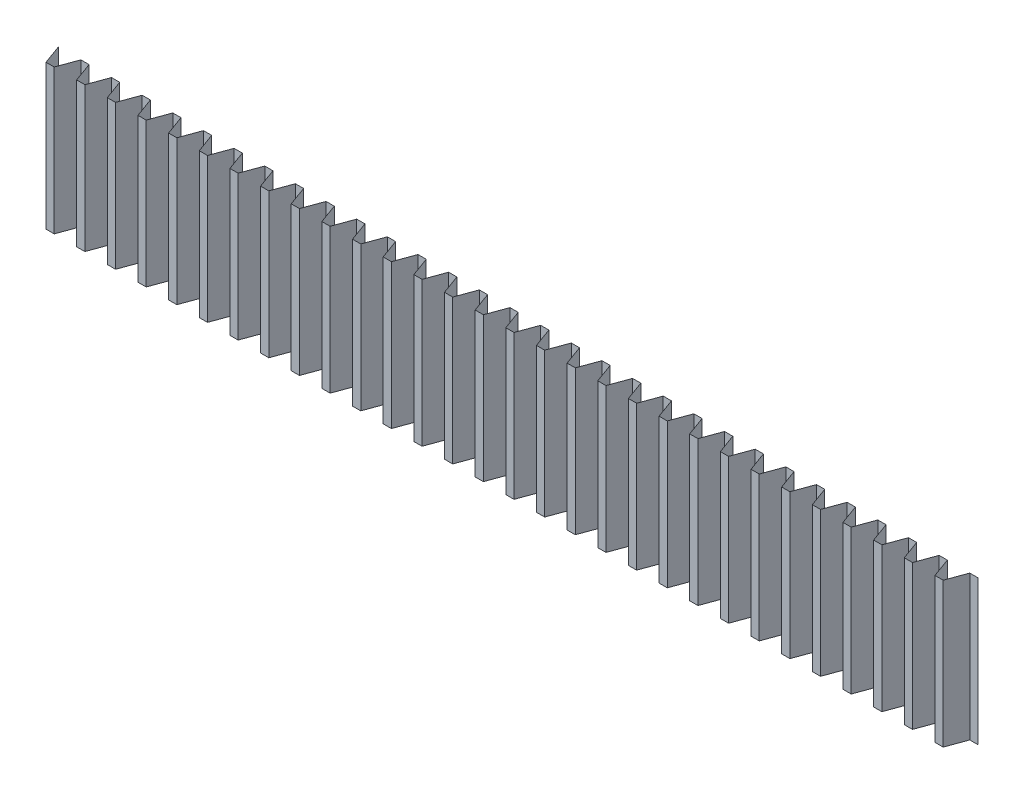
SolidWorks part; units mm, degrees
ref_plane "Vorne" through (0, 0, 0) normal (0, 0, 1) x (1, 0, 0)
ref_plane "Oben" through (0, 0, 0) normal (0, 1, 0) x (1, 0, 0)
ref_plane "Rechts" through (0, 0, 0) normal (1, 0, 0) x (0, 0, -1)
sketch "Skizze1" plane through (0, 0, 0) normal (0, 1, 0) x (1, 0, 0)
  line L0 (-56.2728, 2.7) -> (-53.9971, 2.7)
  line L1 (-53.9971, 2.7) -> (-52.0317, -2.7)
  line L2 (-62.4794, 2.7) -> (-60.514, -2.7)
  line L3 (-60.514, -2.7) -> (-58.2382, -2.7)
  line L4 (-58.2382, -2.7) -> (-56.2728, 2.7)
  line L5 (0, 2.7) -> (0, -2.7) construction
  line L6 (-52.0317, -2.7) -> (-49.7559, -2.7)
  line L7 (-49.7559, -2.7) -> (-47.7905, 2.7)
  line L8 (-47.7905, 2.7) -> (-45.5148, 2.7)
  line L9 (-45.5148, 2.7) -> (-43.5494, -2.7)
  line L10 (-43.5494, -2.7) -> (-41.2736, -2.7)
  line L11 (-41.2736, -2.7) -> (-39.3082, 2.7)
  line L12 (-39.3082, 2.7) -> (-37.0325, 2.7)
  line L13 (-37.0325, 2.7) -> (-35.0671, -2.7)
  line L14 (-35.0671, -2.7) -> (-32.7913, -2.7)
  line L15 (-32.7913, -2.7) -> (-30.8259, 2.7)
  line L16 (-30.8259, 2.7) -> (-28.5502, 2.7)
  line L17 (-28.5502, 2.7) -> (-26.5848, -2.7)
  line L18 (-26.5848, -2.7) -> (-24.309, -2.7)
  line L19 (-24.309, -2.7) -> (-22.3436, 2.7)
  line L20 (-22.3436, 2.7) -> (-20.0679, 2.7)
  line L21 (-20.0679, 2.7) -> (-18.1025, -2.7)
  line L22 (-18.1025, -2.7) -> (-15.8267, -2.7)
  line L23 (-15.8267, -2.7) -> (-13.8613, 2.7)
  line L24 (-13.8613, 2.7) -> (-11.5856, 2.7)
  line L25 (-11.5856, 2.7) -> (-9.6202, -2.7)
  line L26 (-9.6202, -2.7) -> (-7.3444, -2.7)
  line L27 (-7.3444, -2.7) -> (-5.379, 2.7)
  line L28 (-5.379, 2.7) -> (-3.1033, 2.7)
  line L29 (-3.1033, 2.7) -> (-1.1379, -2.7)
  line L30 (-1.1379, -2.7) -> (1.1379, -2.7)
  line L31 (1.1379, -2.7) -> (3.1033, 2.7)
  line L32 (3.1033, 2.7) -> (5.379, 2.7)
  line L33 (5.379, 2.7) -> (7.3444, -2.7)
  line L34 (7.3444, -2.7) -> (9.6202, -2.7)
  line L35 (9.6202, -2.7) -> (11.5856, 2.7)
  line L36 (11.5856, 2.7) -> (13.8613, 2.7)
  line L37 (13.8613, 2.7) -> (15.8267, -2.7)
  line L38 (15.8267, -2.7) -> (18.1025, -2.7)
  line L39 (18.1025, -2.7) -> (20.0679, 2.7)
  line L40 (20.0679, 2.7) -> (22.3436, 2.7)
  line L41 (22.3436, 2.7) -> (24.309, -2.7)
  line L42 (24.309, -2.7) -> (26.5848, -2.7)
  line L43 (26.5848, -2.7) -> (28.5502, 2.7)
  line L44 (28.5502, 2.7) -> (30.8259, 2.7)
  line L45 (30.8259, 2.7) -> (32.7913, -2.7)
  line L46 (32.7913, -2.7) -> (35.0671, -2.7)
  line L47 (35.0671, -2.7) -> (37.0325, 2.7)
  line L48 (37.0325, 2.7) -> (39.3082, 2.7)
  line L49 (39.3082, 2.7) -> (41.2736, -2.7)
  line L50 (41.2736, -2.7) -> (43.5494, -2.7)
  line L51 (43.5494, -2.7) -> (45.5148, 2.7)
  line L52 (45.5148, 2.7) -> (47.7905, 2.7)
  line L53 (47.7905, 2.7) -> (49.7559, -2.7)
  line L54 (49.7559, -2.7) -> (52.0317, -2.7)
  line L55 (52.0317, -2.7) -> (53.9971, 2.7)
  line L56 (53.9971, 2.7) -> (56.2728, 2.7)
  line L57 (56.2728, 2.7) -> (58.2382, -2.7)
  line L58 (58.2382, -2.7) -> (60.514, -2.7)
  line L59 (60.514, -2.7) -> (62.4794, 2.7)
  line L60 (62.4794, 2.7) -> (64.7551, 2.7)
  line L61 (64.7551, 2.7) -> (66.7205, -2.7)
  line L62 (66.7205, -2.7) -> (68.9963, -2.7)
  line L63 (68.9963, -2.7) -> (70.9617, 2.7)
  line L64 (70.9617, 2.7) -> (73.2374, 2.7)
  line L65 (73.2374, 2.7) -> (75.2028, -2.7)
  line L66 (75.2028, -2.7) -> (77.4786, -2.7)
  line L67 (77.4786, -2.7) -> (79.444, 2.7)
  line L68 (79.444, 2.7) -> (81.7197, 2.7)
  line L69 (81.7197, 2.7) -> (83.6851, -2.7)
  line L70 (83.6851, -2.7) -> (85.9609, -2.7)
  line L71 (85.9609, -2.7) -> (87.9263, 2.7)
  line L72 (87.9263, 2.7) -> (90.202, 2.7)
  line L73 (90.202, 2.7) -> (92.1674, -2.7)
  line L74 (92.1674, -2.7) -> (94.4432, -2.7)
  line L75 (94.4432, -2.7) -> (96.4086, 2.7)
  line L76 (96.4086, 2.7) -> (98.6843, 2.7)
  line L77 (98.6843, 2.7) -> (100.6497, -2.7)
  line L78 (100.6497, -2.7) -> (102.9255, -2.7)
  line L79 (102.9255, -2.7) -> (104.8909, 2.7)
  line L80 (104.8909, 2.7) -> (107.1666, 2.7)
  line L81 (-59.3761, 4.3286) -> (-59.3761, -3.91) construction
  line L164 (107.1666, 2.7) -> (109.132, -2.7)
  line L165 (109.132, -2.7) -> (111.4078, -2.7)
  line L166 (111.4078, -2.7) -> (113.3732, 2.7)
  line L167 (113.3732, 2.7) -> (115.6489, 2.7)
  line L168 (115.6489, 2.7) -> (117.6143, -2.7)
  line L169 (117.6143, -2.7) -> (119.8901, -2.7)
  line L170 (119.8901, -2.7) -> (121.8555, 2.7)
  line L171 (121.8555, 2.7) -> (124.1312, 2.7)
  line L172 (124.1312, 2.7) -> (126.0966, -2.7)
  line L173 (126.0966, -2.7) -> (128.3724, -2.7)
  line L174 (128.3724, -2.7) -> (130.3378, 2.7)
  line L175 (130.3378, 2.7) -> (132.6135, 2.7)
  line L176 (132.6135, 2.7) -> (134.5789, -2.7)
  line L177 (134.5789, -2.7) -> (136.8547, -2.7)
  line L178 (136.8547, -2.7) -> (138.8201, 2.7)
  line L179 (138.8201, 2.7) -> (141.0958, 2.7)
  line L180 (141.0958, 2.7) -> (143.0612, -2.7)
  line L181 (143.0612, -2.7) -> (145.337, -2.7)
  line L182 (145.337, -2.7) -> (147.3024, 2.7)
  line L183 (147.3024, 2.7) -> (149.5781, 2.7)
  line L184 (149.5781, 2.7) -> (151.5435, -2.7)
  line L185 (151.5435, -2.7) -> (153.8193, -2.7)
  line L186 (153.8193, -2.7) -> (155.7847, 2.7)
  line L187 (155.7847, 2.7) -> (158.0604, 2.7)
  line L188 (158.0604, 2.7) -> (160.0258, -2.7)
  line L189 (160.0258, -2.7) -> (162.3016, -2.7)
  line L190 (162.3016, -2.7) -> (164.267, 2.7)
  line L191 (164.267, 2.7) -> (166.5427, 2.7)
  line L192 (166.5427, 2.7) -> (168.5081, -2.7)
  line L193 (168.5081, -2.7) -> (170.7839, -2.7)
  line L194 (170.7839, -2.7) -> (172.7493, 2.7)
  line L195 (172.7493, 2.7) -> (175.025, 2.7)
  line L196 (175.025, 2.7) -> (176.9904, -2.7)
  line L197 (176.9904, -2.7) -> (179.2662, -2.7)
  line L198 (179.2662, -2.7) -> (181.2316, 2.7)
  line L199 (181.2316, 2.7) -> (183.5073, 2.7)
  line L200 (183.5073, 2.7) -> (185.4727, -2.7)
  line L201 (185.4727, -2.7) -> (187.7485, -2.7)
  line L202 (187.7485, -2.7) -> (189.7139, 2.7)
  line L203 (189.7139, 2.7) -> (191.9896, 2.7)
  dimension "D1" = 40
  dimension "D2" = 30
  dimension "D3" = 20
  dimension "D4" = 20
  dimension "D5" = 8.4823
  dimension "D6" = 40
surface "Bezugsprofil" sketch "Skizze1" parameters "D1"=40
equation "\"Teilung\"=\"Modul\"* pi "
equation "\"Kopfspiel\"=\"Modul\" * 0.167"
